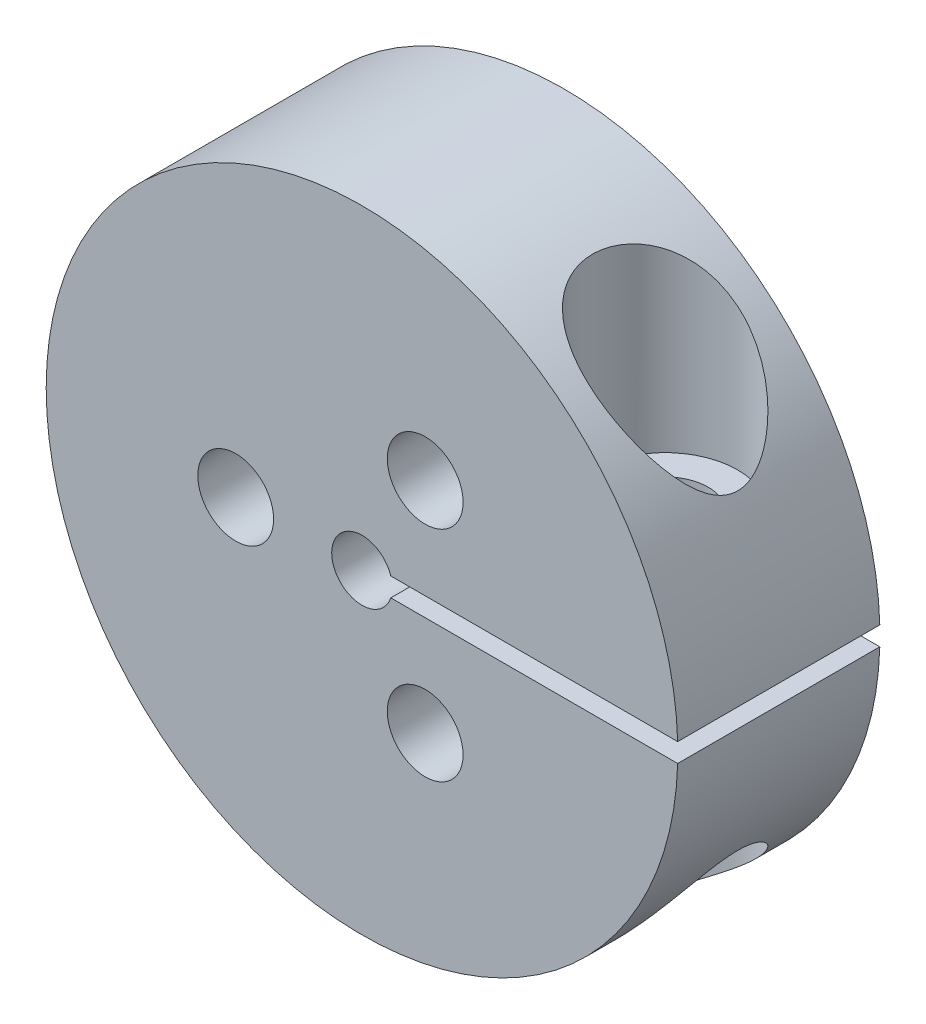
SolidWorks part; units mm, degrees
ref_plane "Front Plane" through (0, 0, 0) normal (0, 0, 1) x (1, 0, 0)
ref_plane "Top Plane" through (0, 0, 0) normal (0, 1, 0) x (1, 0, 0)
ref_plane "Right Plane" through (0, 0, 0) normal (1, 0, 0) x (0, 0, -1)
sketch "Sketch1" plane through (0, 0, 0) normal (0, 0, 1) x (1, 0, 0)
  line L0 (0, 0) -> (5.5204, 9.5617) construction
  line L1 (0, 0) -> (-7.7529, 0) construction
  line L2 (0, 0) -> (4.7704, -8.2626) construction
  line L3 (55, 0) -> (-55, 0) construction
  line L4 (0, -0.375) -> (12.4944, -0.375)
  line L5 (0, -0.375) -> (0, 0.375)
  line L6 (0, 0.375) -> (12.4944, 0.375)
  line L8 (0, -55) -> (0, 55) construction
  arc A0 (12.4944, 0.375) -> (12.4944, -0.375) centre (0, 0) ccw
  circle A1 centre (0, 0) radius 1.2
  circle A2 centre (2.5, 4.3301) radius 1.5
  circle A3 centre (2.5, -4.3301) radius 1.5
  circle A4 centre (-5, 0) radius 1.5
  circle A5 centre (0, 0) radius 5 construction
  point P14 (0, 0)
  dimension "D1" = 2.4
  dimension "D2" = 25
  dimension "D5" = 3
  dimension "D6" = 10
  dimension "D3" = 120
  dimension "D4" = 120
  dimension "D7" = 0.75
extrude "Boss-Extrude1" add sketch "Sketch1" along normal mid plane 8 contours A1 L6 A0 L4 A4 A3 A2
sketch "Sketch2" plane through (0, 0, 0) normal (0, 1, 0) x (1, 0, 0)
  line L0 (-13.7469, 0) -> (13.7469, 0) construction
  line L1 (0, -4.4) -> (0, 4.4) construction
  circle A0 centre (8, 0) radius 1.55
  dimension "D1" = 3.1
  dimension "D2" = 8
extrude "Cut-Extrude1" cut sketch "Sketch2" against normal through all and the other way through all contours A0
ref_plane "Plane1" through (0, 4, 0) normal (0, 1, 0) x (1, 0, 0)
sketch "Sketch3" plane through (0, 4, 0) normal (0, 1, 0) x (1, 0, 0)
  circle A0 centre (8, 0) radius 2.875
  dimension "D1" = 5.75
extrude "Cut-Extrude2" cut sketch "Sketch3" along normal through all
mirror "Mirror1" about plane through (0, 0, 0) normal (0, 1, 0) of "Cut-Extrude2"
sketch "Sketch4" plane through (0, 4, 0) normal (0, 1, 0) x (1, 0, 0)
  circle A0 centre (8, 0) radius 1.7
  dimension "D1" = 3.4
extrude "Cut-Extrude3" cut sketch "Sketch4" against normal up to next
